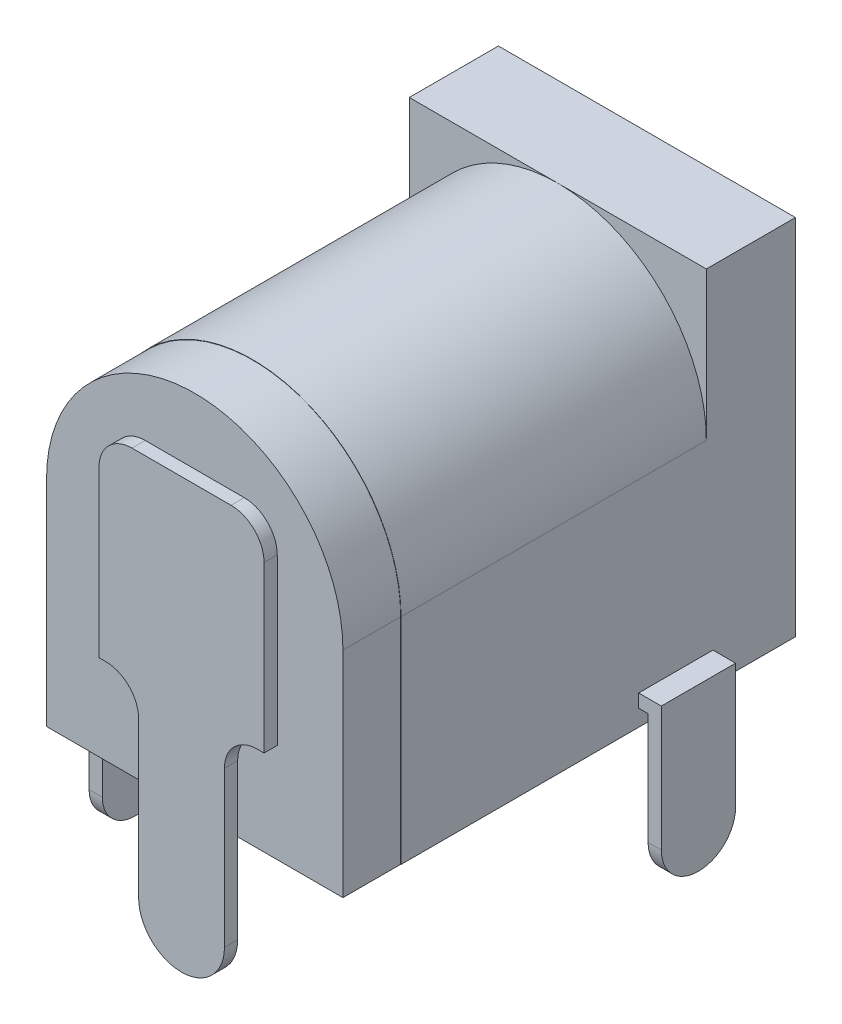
SolidWorks part; units mm, degrees
ref_plane "Plan de face" through (0, 0, 0) normal (0, 0, 1) x (1, 0, 0)
ref_plane "Plan de dessus" through (0, 0, 0) normal (0, 1, 0) x (1, 0, 0)
ref_plane "Plan de droite" through (0, 0, 0) normal (1, 0, 0) x (0, 0, -1)
sketch "Esquisse1" plane through (0, 0, 0) normal (0, 0, 1) x (1, 0, 0)
  line L0 (0, -6.0433) -> (0, 37.3263) construction
  line L1 (-10.0722, 0) -> (24.4251, 0) construction
  line L2 (-4.5, 11.8416) -> (-4.5, -3.2796) construction
  line L3 (-2.0077, 6.5) -> (2.0892, 6.5) construction
  line L4 (-11.6663, 11) -> (1.9154, 11) construction
  line L5 (4.5, -1.9139) -> (4.5, 13.9273) construction
  line L6 (4.5, 6.5) -> (4.5, 0)
  line L7 (4.5, 0) -> (-4.5, 0)
  line L8 (-4.5, 0) -> (-4.5, 6.5)
  arc A0 (4.5, 6.5) -> (-4.5, 6.5) centre (0, 6.5) ccw
  dimension "D1" = 11
  dimension "D2" = 4.5
  dimension "D3" = 4.5
  dimension "D4" = 4.5
extrude "Extrusion1" add sketch "Esquisse1" along normal blind 9.25
sketch "Esquisse2" plane through (0, 0, 9.25) normal (0, 0, 1) x (1, 0, 0)
  line L0 (-6.0566, 0) -> (5.9794, 0) construction
  line L1 (4.49, 6.4943) -> (4.49, 0)
  line L2 (4.48, -1.3487) -> (4.4971, 12.0589) construction
  line L3 (4.49, 0) -> (-4.49, 0)
  line L4 (5.2397, 11) -> (-6.0566, 11) construction
  line L5 (-4.49, 0) -> (-4.49, 6.5)
  line L6 (-4.4835, 11.7885) -> (-4.5, -1.6772) construction
  line L7 (0, -1.6772) -> (0, 12.5999) construction
  line L8 (-2.9076, 6.5) -> (1.8836, 6.5) construction
  arc A0 (4.49, 6.4943) -> (-4.49, 6.5) centre (0, 6.5) ccw
extrude "Extrusion2" add sketch "Esquisse2" along normal blind 1.75
sketch "Esquisse3" plane through (0, 0, 0) normal (0, 0, -1) x (-1, 0, 0)
  line L0 (-5.11, 0) -> (6.3658, 0) construction
  line L1 (-4.5, -0.5566) -> (-4.5, 12.1942) construction
  line L2 (-5.3805, 11) -> (6.7328, 11) construction
  line L3 (4.5, -0.7692) -> (4.5, 11.8851) construction
  line L5 (-4.5, 11) -> (4.5, 11)
  line L6 (-4.5, 11) -> (-4.5, 0)
  line L7 (-4.5, 0) -> (4.5, 0)
  line L8 (4.5, 11) -> (4.5, 0)
extrude "Extrusion3" add sketch "Esquisse3" along normal blind 2.7
sketch "Esquisse5" plane through (0, 0, -2.7) normal (0, 0, -1) x (-1, 0, 0)
  line L0 (0, -1.258) -> (0, 10.1946) construction
  line L1 (-3.3036, 6.5) -> (2.3299, 6.5) construction
  circle A0 centre (0, 6.5) radius 3.1
extrude "Enlèv. mat.-Extru.1" cut sketch "Esquisse5" against normal blind 10
sketch "Esquisse6" plane through (0, 0, 7.3) normal (0, 0, -1) x (-1, 0, 0)
  line L0 (0, 2.9064) -> (0, 8.7198) construction
  line L1 (-0.816, 6.5) -> (1.8351, 6.5) construction
  circle A0 centre (0, 6.5) radius 1
extrude "Extrusion4" add sketch "Esquisse6" along normal blind 8
fillet "Congé1" radius 0.99 1 edges at (-1, 6.5, -0.7)
sketch "Esquisse7" plane through (0, 0, 11) normal (0, 0, 1) x (1, 0, 0)
  line L0 (0, -9.1727) -> (0, 13.5797) construction
  line L1 (-1.4786, 6.5) -> (3.0378, 6.5) construction
  line L2 (-2.5, 12.2746) -> (-2.5, -1.2249) construction
  line L3 (2.5, 12.2746) -> (2.5, -1.2249) construction
  line L4 (-1.3, 4.5898) -> (-1.3, -9.1727) construction
  line L5 (-5.8045, 9) -> (8.4254, 9) construction
  line L6 (-3.3501, 3) -> (-0.4866, 3) construction
  line L7 (-5.1909, -4) -> (7.5781, -4) construction
  line L8 (-6.7103, 0) -> (7.1398, 0) construction
  line L9 (1.5, 9) -> (-1.5, 9)
  line L10 (-2.5, 8) -> (-2.5, 3)
  line L11 (-2.5, 3) -> (-2.3, 3)
  line L12 (-1.3, 2) -> (-1.3, -2.7)
  line L13 (0.6915, -2.7) -> (-2.3, -2.7) construction
  line L14 (1.3, 2) -> (1.3, -2.7)
  line L15 (2.5, 3) -> (2.3, 3)
  line L16 (2.5, 8) -> (2.5, 3)
  arc A0 (-1.5, 9) -> (-2.5, 8) centre (-1.5, 8) ccw
  arc A1 (-2.3, 3) -> (-1.3, 2) centre (-2.3, 2) cw
  arc A2 (-1.3, -2.7) -> (1.3, -2.7) centre (0, -2.7) ccw
  arc A3 (2.3, 3) -> (1.3, 2) centre (2.3, 2) ccw
  arc A4 (1.5, 9) -> (2.5, 8) centre (1.5, 8) cw
  point P38 (0, 9)
  dimension "D7" = 1
  dimension "D8" = 1.3
  dimension "D1" = 2.5
  dimension "D2" = 2.5
  dimension "D3" = 4
  dimension "D4" = 9
  dimension "D5" = 6
  dimension "D6" = 1.3
extrude "Extrusion5" add sketch "Esquisse7" along normal blind 0.4
sketch "Esquisse8" plane through (4.5, 0, 0) normal (1, 0, 0) x (0, 0, -1)
  line L0 (-10.5, -5.9247) -> (-10.5, 12.8028) construction
  line L1 (-0.8, -5.9247) -> (-0.8, 2.3661) construction
  line L2 (-9.4524, -4) -> (5.5198, -4) construction
  line L3 (3.2764, 0.5) -> (-3.405, 0.5) construction
  line L4 (5.3168, 0.9) -> (-3.405, 0.9) construction
  line L5 (0.2, -1.0965) -> (0.2, 2.6344) construction
  line L6 (-2.05, -1.0965) -> (-2.05, 2.3661) construction
  line L7 (3.133, 0) -> (4.7289, 0) construction
  line L8 (5.3168, 0.7) -> (-1.705, 0.7) construction
  line L9 (-2.05, 0.9) -> (0.2, 0.9)
  line L10 (-2.05, 0.9) -> (-2.05, 0.5)
  line L11 (-2.05, 0.5) -> (0.2, 0.5)
  line L12 (0.2, 0.9) -> (0.2, 0.5)
  dimension "D1" = 9.7
  dimension "D2" = 1.25
  dimension "D3" = 2.25
  dimension "D4" = 0.5
  dimension "D5" = 0.4
  dimension "D6" = 0.2
ref_plane "Plan1" through (0, 0, 0.8) normal (0, 0, 1) x (1, 0, 0)
sketch "Esquisse9" plane through (0, 0, 0.8) normal (0, 0, 1) x (1, 0, 0)
  line L0 (4.5, -9.0621) -> (4.5, 15.3025) construction
  line L1 (5, 1.8803) -> (5, -8.4324) construction
  line L2 (1.0558, -4) -> (7.9046, -4) construction
  line L3 (4.5, 0.7145) -> (8.888, 0.7145) construction
  line L4 (4.5, 0.7145) -> (5, 0.7145)
  line L5 (5, 0.7145) -> (5, -4)
  dimension "D1" = 0.5
sweep "Balayage1" add profiles "Esquisse8" path "Esquisse9"
fillet "Congé2" radius 1.124 2 edges at (4.9855, -4, -0.2) (4.9855, -4, 2.05)
sketch "Esquisse10" plane through (-4.5, 0, 0) normal (-1, 0, 0) x (0, 0, 1)
  line L0 (12.4001, 0) -> (-6.8868, 0) construction
  line L1 (12.4001, 4.6) -> (-0.638, 4.6) construction
  line L2 (11.3406, 4.8) -> (5.027, 4.8) construction
  line L3 (11.5569, 5) -> (4.5729, 5) construction
  line L4 (9, 2.0751) -> (9, 5.2752) construction
  line L5 (7, 5.2752) -> (7, 2.0751) construction
  line L6 (10.5, -5.7305) -> (10.5, -2.7) construction
  line L7 (8, 5.1454) -> (8, -5.7305) construction
  line L9 (7, 5) -> (9, 5)
  line L10 (7, 5) -> (7, 4.6)
  line L11 (7, 4.6) -> (9, 4.6)
  line L12 (9, 5) -> (9, 4.6)
  dimension "D1" = 2.5
  dimension "D2" = 5
  dimension "D3" = 0.2
  dimension "D4" = 0.2
  dimension "D5" = 1
  dimension "D6" = 1
ref_plane "Plan2" through (0, 0, 8) normal (0, 0, 1) x (1, 0, 0)
sketch "Esquisse11" plane through (0, 0, 8) normal (0, 0, 1) x (1, 0, 0)
  line L0 (4.456, -4) -> (-6.8901, -4) construction
  line L1 (-5, -4.7028) -> (-5, 6.1845) construction
  line L2 (-4.5, 4.8) -> (-5.8461, 4.8) construction
  line L3 (-4.5, 4.8) -> (-5, 4.8)
  line L4 (-5, 4.8) -> (-5, -4)
  line L5 (-4.5, -8.6321) -> (-4.5, 15.6475) construction
  dimension "D1" = 0.5
sweep "Balayage2" add profiles "Esquisse10" path "Esquisse11"
fillet "Congé3" radius 0.99 2 edges at (-5, -4, 9) (-5, -4, 7)
